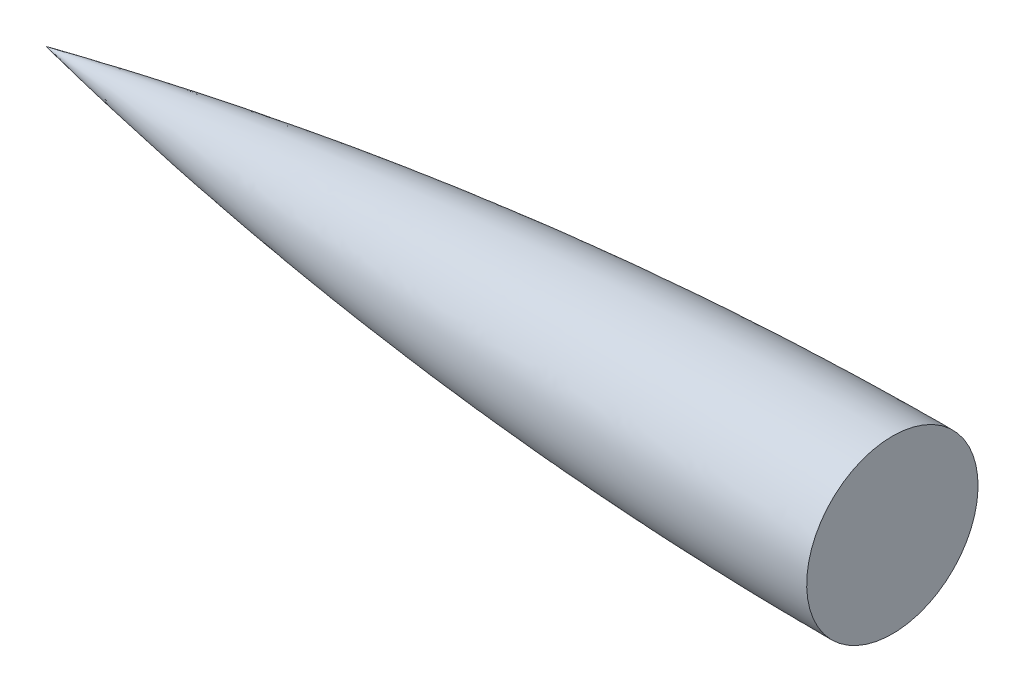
SolidWorks part; units mm, degrees
ref_plane "Front Plane" through (0, 0, 0) normal (0, 0, 1) x (1, 0, 0)
ref_plane "Top Plane" through (0, 0, 0) normal (0, 1, 0) x (1, 0, 0)
ref_plane "Right Plane" through (0, 0, 0) normal (1, 0, 0) x (0, 0, -1)
sketch "Sketch1" plane through (0, 0, 0) normal (0, 0, 1) x (1, 0, 0)
  line L0 (0, 0) -> (-67.7418, 0) construction
  line L1 (0, 0) -> (0, 6.858)
  line L2 (0, 0) -> (-67.7418, 0)
  arc A0 (0, 6.858) -> (-67.7418, 0) centre (0, -331.1402) ccw
  dimension "D1" = 67.7418
  dimension "D2" = 6.858
revolve "Revolve1" add sketch "Sketch1" angle 360 about L0
